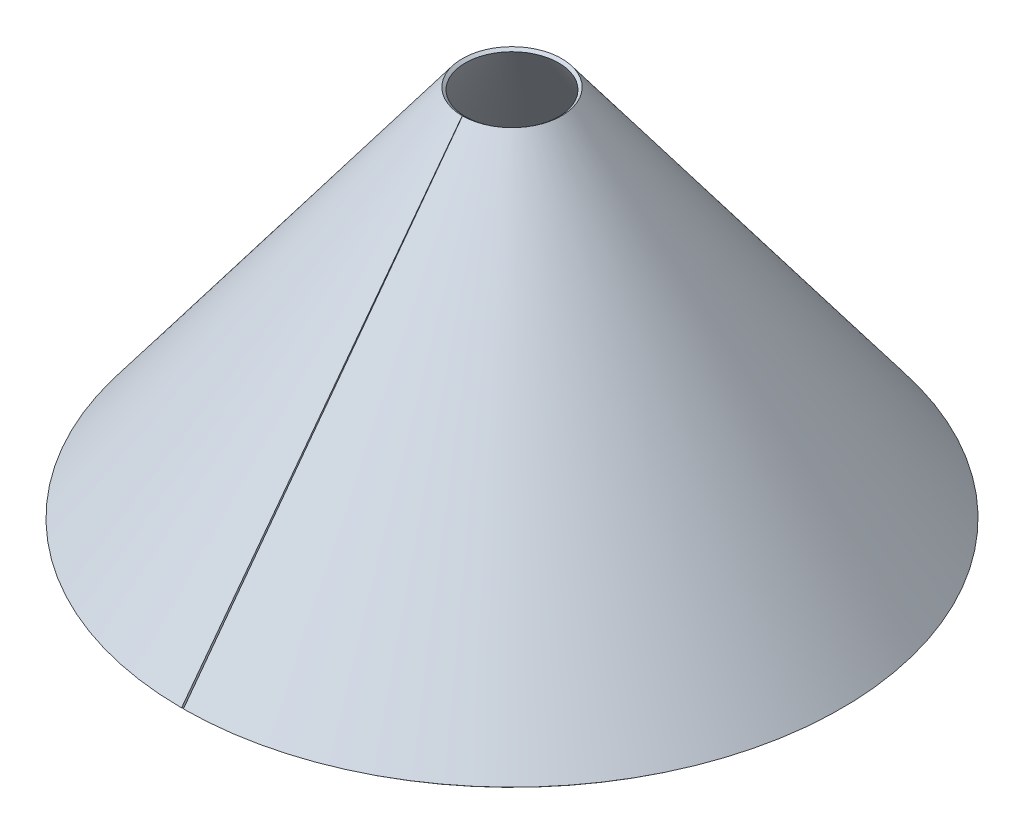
SolidWorks part; units mm, degrees
ref_plane "Front" through (0, 0, 0) normal (0, 0, 1) x (1, 0, 0)
ref_plane "Top" through (0, 0, 0) normal (0, 1, 0) x (1, 0, 0)
ref_plane "Right" through (0, 0, 0) normal (1, 0, 0) x (0, 0, -1)
sketch "Sketch1" plane through (0, 0, 0) normal (0, 1, 0) x (1, 0, 0)
  line L0 (0, 28.5022) -> (0, -185.4002) construction
  arc A0 (0.5, -174.9993) -> (-0.5, -174.9993) centre (0, 0) ccw
  dimension "D1" = 350
  dimension "D2" = 1
ref_plane "Plane1" through (0, 200, 0) normal (0, 1, 0) x (-1, 0, 0)
sketch "Sketch2" plane through (0, 200, 0) normal (0, 1, 0) x (-1, 0, 0)
  arc A2 (-0.0714, 24.9999) -> (0.0714, 24.9999) centre (0, 0) ccw
  arc A3 (-0.0714, 24.9999) -> (0.0714, 24.9999) centre (0, 0) ccw
  dimension "D1" = 150
sheet metal parameters "Sheet-Metal1" thickness 2 parameters "D1"=2, "Dicke"=2
lofted bend "Lofted Bends1" parameters "D1"=0, "D12"=2
other "Freeform Bend1" parameters "D1"=1000, "D4"=0.327, "D5"=1
flat pattern "Flat-Pattern1"
sketch "Sketch4" plane through (0, 0, 0) normal (0, 1, 0) x (-1, 0, 0)
other "Flatten-<Freeform Bend1>1"
